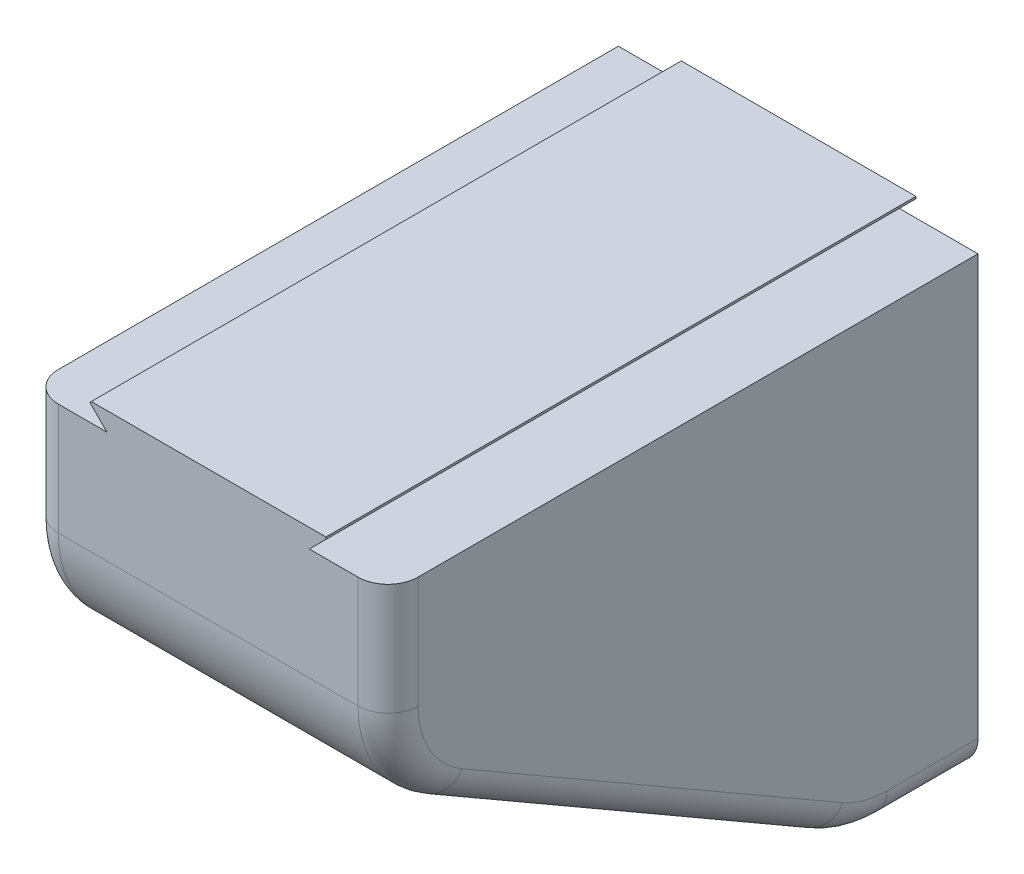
SolidWorks part; units mm, degrees
ref_plane "Front Plane" through (0, 0, 0) normal (0, 0, 1) x (1, 0, 0)
ref_plane "Top Plane" through (0, 0, 0) normal (0, 1, 0) x (1, 0, 0)
ref_plane "Right Plane" through (0, 0, 0) normal (1, 0, 0) x (0, 0, -1)
other "Configuration Table"
sketch "Sketch1" plane through (0, 0, 0) normal (1, 0, 0) x (0, 0, -1)
  line L0 (0, 0) -> (-500, 0)
  line L1 (-500, 0) -> (-500, -152.4)
  line L2 (0, -381) -> (-104.0532, -381)
  line L3 (0, -381) -> (0, 0)
  line L4 (-104.0532, -381) -> (-500, -152.4)
  dimension "D1" = 500
  dimension "D2" = 381
  dimension "D3" = 152.4
  dimension "D4" = 30
extrude "Extrude1" add sketch "Sketch1" along normal mid plane 304.8
sketch "Sketch2" plane through (0, 0, 0) normal (0, 0, -1) x (-1, 0, 0)
  line L0 (-85.725, 0) -> (-101.6, 15.875)
  line L1 (-152.4, 0) -> (152.4, 0) construction
  line L2 (-101.6, 15.875) -> (101.6, 15.875)
  line L3 (101.6, 15.875) -> (85.725, 0)
  line L4 (0, 0) -> (0, 15.875) construction
  line L9 (152.4, -381) -> (152.4, 0)
  line L10 (152.4, 0) -> (-152.4, 0)
  line L11 (-152.4, 0) -> (-152.4, -381)
  line L12 (-152.4, -381) -> (152.4, -381)
  line L14 (85.725, 0) -> (-85.725, 0)
  dimension "D1" = 203.2
  dimension "D2" = 45
  dimension "D3" = 15.875
  dimension "D4" = 0
extrude "Extrude2" add sketch "Sketch2" against normal through all
chamfer "Chamfer1" distance 2.54 angle 45 2 edges at (-101.6, 15.875, 250) (101.6, 15.875, 250)
fillet "Fillet1" radius 100 2 edges at (0, -381, 104.0532) (0, -152.4, 500)
fillet "Fillet2" radius 25.4 10 edges at (-152.4, -381, 38.6291) (-152.4, -377.5926, 103.1402) (-152.4, -274.435, 288.6291) (-152.4, -144.665, 486.6025) (152.4, -381, 38.6291) (152.4, -377.5926, 103.1402) (152.4, -274.435, 288.6291) (152.4, -144.665, 486.6025) (-152.4, -47.3325, 500) (152.4, -47.3325, 500)
